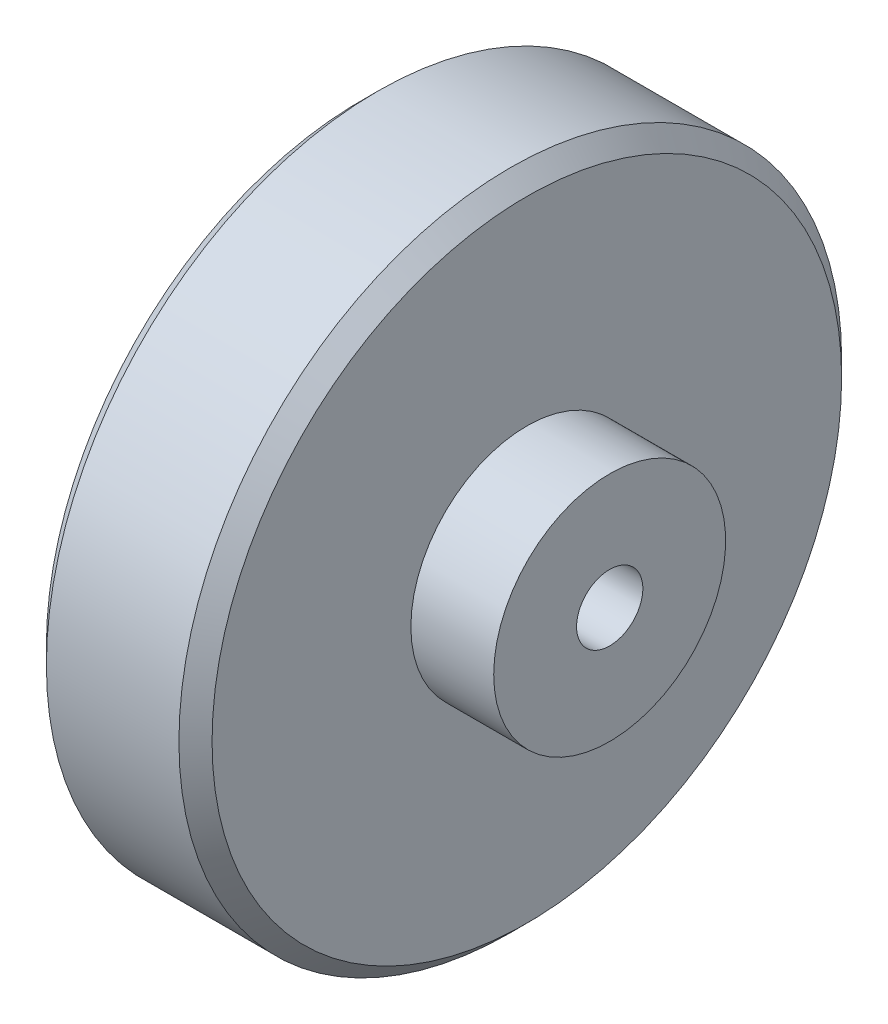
SolidWorks part; units mm, degrees
ref_plane "Front" through (0, 0, 0) normal (0, 0, 1) x (1, 0, 0)
ref_plane "Top" through (0, 0, 0) normal (0, 1, 0) x (1, 0, 0)
ref_plane "Right" through (0, 0, 0) normal (1, 0, 0) x (0, 0, -1)
sketch "Sketch1" plane through (0, 0, 0) normal (0, 0, 1) x (1, 0, 0)
  line L0 (0, 0) -> (15, 0)
  line L1 (15, 2) -> (15, 7)
  line L2 (15, 7) -> (10, 7)
  line L3 (10, 7) -> (10, 20)
  line L4 (10, 20) -> (0, 20)
  line L5 (0, 20) -> (0, 2)
  line L6 (0, 2) -> (15, 2)
revolve "Revolve1" add sketch "Sketch1" angle 360 about L0
chamfer "Chamfer1" distance 1 angle 45 2 edges at (10, 0, 20) (0, 0, 20)
